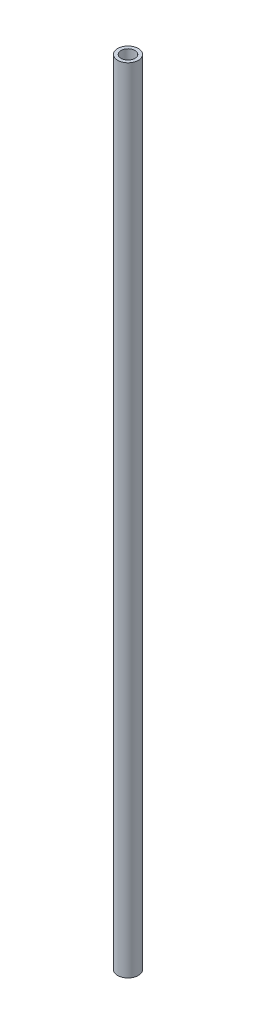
SolidWorks part; units mm, degrees
ref_plane "Front Plane" through (0, 0, 0) normal (0, 0, 1) x (1, 0, 0)
ref_plane "Top Plane" through (0, 0, 0) normal (0, 1, 0) x (1, 0, 0)
ref_plane "Right Plane" through (0, 0, 0) normal (1, 0, 0) x (0, 0, -1)
sketch "Sketch1" plane through (0, 0, 0) normal (0, 1, 0) x (1, 0, 0)
  circle A0 centre (0, 0) radius 2.667
  circle A1 centre (0, 0) radius 3.9624
  dimension "D1" = 5.334
  dimension "D2" = 7.9248
extrude "Boss-Extrude1" add sketch "Sketch1" along normal blind 304.8
